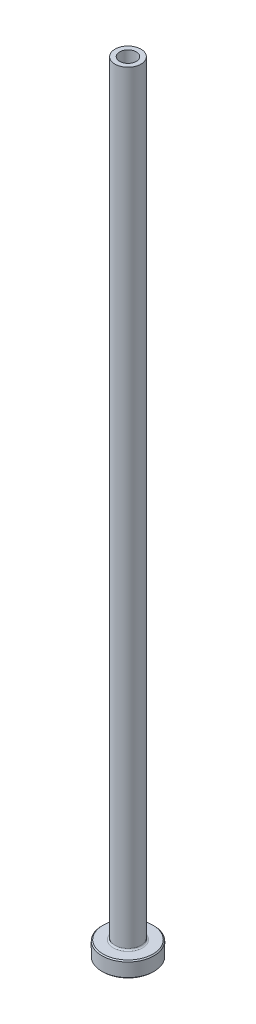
SolidWorks part; units mm, degrees
ref_plane "Front Plane" through (0, 0, 0) normal (0, 0, 1) x (1, 0, 0)
ref_plane "Top Plane" through (0, 0, 0) normal (0, 1, 0) x (1, 0, 0)
ref_plane "Right Plane" through (0, 0, 0) normal (1, 0, 0) x (0, 0, -1)
sketch "Sketch1" plane through (0, 0, 0) normal (0, 0, 1) x (1, 0, 0)
  line L0 (-1.6, 150) -> (-2.5, 150)
  line L1 (-2.5, 150) -> (-2.5, 3)
  line L2 (-2.5, 3) -> (-5, 3)
  line L3 (-5, 3) -> (-5, 0)
  line L4 (5.5, 0) -> (-5.5, 0) construction
  line L5 (-5, 0) -> (-1.85, 0)
  line L6 (-1.6, 105) -> (-1.6, 150)
  line L7 (0, 92.1877) -> (0, -15.5353) construction
  line L8 (0, -5.5) -> (0, 5.5) construction
  line L9 (-1.6, 105) -> (-1.85, 93)
  line L10 (-1.85, 93) -> (-1.85, 0)
  dimension "D1" = 0.25
  dimension "ID" = 3.2
  dimension "OD" = 5
  dimension "L" = 150
  dimension "H" = 10
  dimension "T" = 3
  dimension "N" = 45
  dimension "D2" = 12
revolve "Revolve1" add sketch "Sketch1" angle 360 about L7
fillet "Fillet1" radius 0.3 1 edges at (0, 3, 2.5)
chamfer "Chamfer1" distance 0.2 angle 45 2 edges at (0, 3, 5) (0, 0, 5)
chamfer "Chamfer3" distance 0.5 angle 45 1 edges at (0, 0, 1.85)
